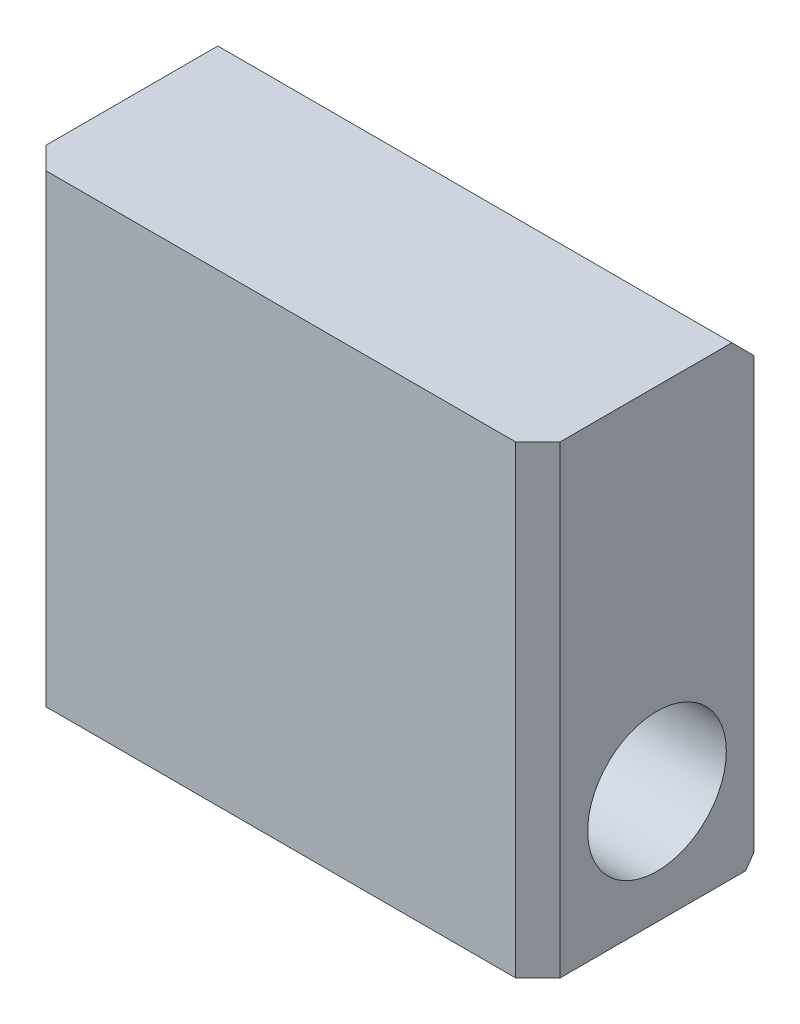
SolidWorks part; units mm, degrees
ref_plane "Спереди" through (0, 0, 0) normal (0, 0, 1) x (1, 0, 0)
ref_plane "Сверху" through (0, 0, 0) normal (0, 1, 0) x (1, 0, 0)
ref_plane "Справа" through (0, 0, 0) normal (1, 0, 0) x (0, 0, -1)
sketch "Эскиз1" plane through (0, 0, 0) normal (1, 0, 0) x (0, 0, -1)
  line L1 (-6.1468, -5.842) -> (6.1468, -5.842)
  line L2 (-6.1468, -5.842) -> (-6.1468, 18.1102)
  line L3 (-6.1468, 18.1102) -> (6.1468, 18.1102)
  line L4 (6.1468, -5.842) -> (6.1468, 18.1102)
  circle A0 centre (0, 0) radius 3.5776
  dimension "D1" = 7.1552
  dimension "D2" = 5.842
  dimension "D3" = 6.1468
  dimension "D4" = 23.9522
  dimension "D5" = 12.2936
extrude "Бобышка-Вытянуть1" add sketch "Эскиз1" along normal mid plane 26.5176
chamfer "Фаска1" distance 1.143 angle 45 4 edges at (-13.2588, 6.1341, -6.1468) (13.2588, 6.1341, -6.1468) (-13.2588, 6.1341, 6.1468) (13.2588, 6.1341, 6.1468)
sketch "Эскиз2" plane through (13.2588, 0, 0) normal (1, 0, 0) x (0, 0, -1)
  line L0 (4.572, -5.842) -> (6.1468, -3.593)
  line L1 (-5.0038, -5.842) -> (5.0038, -5.842) construction
  line L2 (6.1468, -3.593) -> (6.1468, -5.842)
  line L3 (6.1468, -5.842) -> (4.572, -5.842)
  line L4 (3.8608, 18.1102) -> (6.1468, 18.1102)
  line L5 (5.0038, 18.1102) -> (-5.0038, 18.1102) construction
  line L6 (6.1468, 18.1102) -> (6.1468, 13.506)
  line L7 (6.1468, 13.506) -> (5.3381, 16.6329)
  line L8 (5.3381, 16.6329) -> (3.8608, 18.1102)
  line L9 (6.1468, 18.1102) -> (6.1468, -5.842) construction
  line L10 (-6.1468, -5.842) -> (-6.1468, 18.1102) construction
  point P15 (4.6482, 17.3228)
  point P16 (5.8166, 14.7828)
  dimension "D1" = 10.7188
  dimension "D2" = 55
  dimension "D3" = 14.5
  dimension "D4" = 45
  dimension "D5" = 10.795
  dimension "D6" = 23.1648
  dimension "D7" = 20.6248
  dimension "D8" = 11.9634
extrude "Вырез-Вытянуть1" cut sketch "Эскиз2" against normal through all
